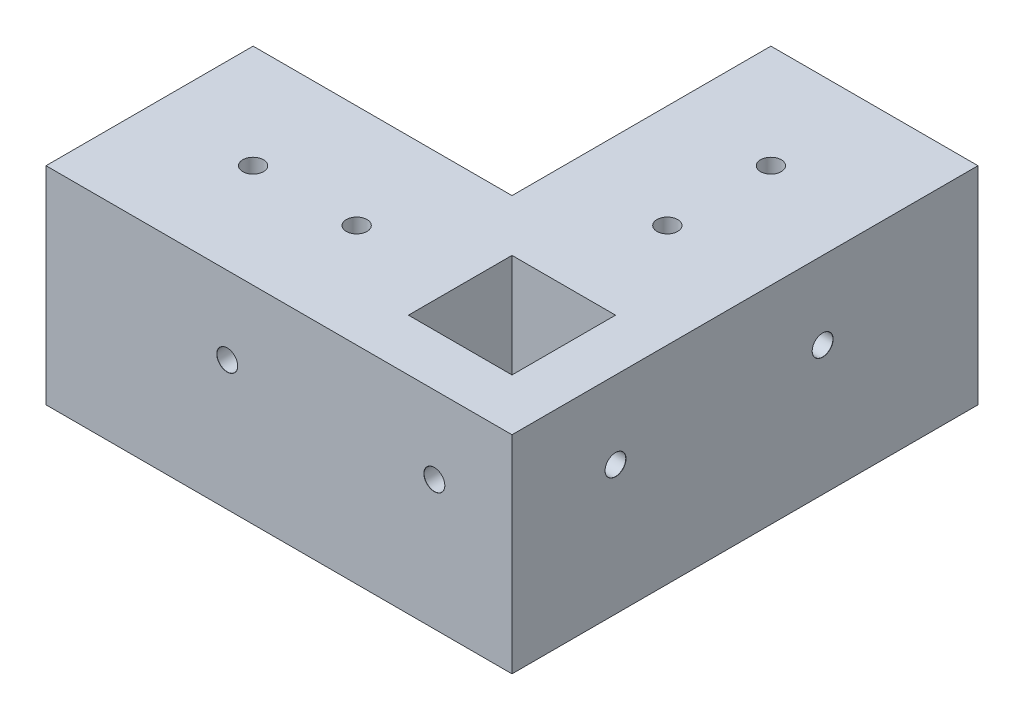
SolidWorks part; units mm, degrees
ref_plane "Front Plane" through (0, 0, 0) normal (0, 0, 1) x (1, 0, 0)
ref_plane "Top Plane" through (0, 0, 0) normal (0, 1, 0) x (1, 0, 0)
ref_plane "Right Plane" through (0, 0, 0) normal (1, 0, 0) x (0, 0, -1)
sketch "Sketch2" plane through (0, 0, 0) normal (0, 1, 0) x (1, 0, 0)
  line L0 (0, 0) -> (-50, 0)
  line L1 (-50, 0) -> (-50, -40)
  line L2 (-50, -40) -> (40, -40)
  line L3 (40, -40) -> (40, 50)
  line L4 (40, 50) -> (0, 50)
  line L5 (0, 50) -> (0, 0)
  dimension "D1" = 40
  dimension "D2" = 40
  dimension "D3" = 50
  dimension "D4" = 50
extrude "Boss-Extrude1" add sketch "Sketch2" along normal blind 40 contours L4 L5 L0 L1 L2 L3
sketch "Sketch6" plane through (40, 0, 0) normal (1, 0, 0) x (0, 0, -1)
  line L0 (-40, 40) -> (-40, 0) construction
  line L1 (-40, 40) -> (50, 40) construction
  point P0 (-20, 25)
  point P2 (-20, -5)
  point P11 (20, 25)
  point P13 (20, -5)
  dimension "D1" = 20
  dimension "D2" = 15
  dimension "D3" = 30
  dimension "D4" = 40
hole_wizard "Ø4.0mm Dowel Hole1" positions "Sketch6" profile "Sketch8" hole size "Ø4.0" standard "ANSI Metric"
sketch "Sketch8" plane through (40, 25, 20) normal (0, 1, 0) x (0, 0, -1)
  line L0 (0, 0) -> (0, 11.2017)
  line L1 (0, 11.2017) -> (2, 10)
  line L2 (2, 10) -> (2, 0.025)
  line L3 (2, 0.025) -> (2.025, 0)
  line L5 (2.025, 0) -> (0, 0)
  line L6 (-2, 0.025) -> (-2.025, 0) construction
  line L10 (0, 11.2017) -> (-2, 10) construction
  line L11 (0, -6.35) -> (0, 107.95) construction
  dimension "Hole Dia." = 4
  dimension "Hole Depth" = 10
  dimension "Near C'Sink Dia." = 4.05
  dimension "Near C'Sink Angle" = 90
  dimension "Drill Angle" = 118
sketch "Sketch13" plane through (0, 0, 40) normal (0, 0, 1) x (1, 0, 0)
  line L0 (40, 40) -> (40, 0) construction
  line L1 (-50, 40) -> (40, 40) construction
  point P0 (25, 25)
  point P2 (25, -5)
  point P15 (-15, 25)
  point P16 (-15, -5)
  dimension "D1" = 15
  dimension "D2" = 30
  dimension "D3" = 15
  dimension "D4" = 40
hole_wizard "Ø4.0mm Dowel Hole3" positions "Sketch13" profile "Sketch14" hole size "Ø4.0" standard "ANSI Metric"
sketch "Sketch14" plane through (25, 25, 40) normal (1, 0, 0) x (0, -1, 0)
  line L0 (0, 0) -> (0, 11.2017)
  line L1 (0, 11.2017) -> (2, 10)
  line L2 (2, 10) -> (2, 0.025)
  line L3 (2, 0.025) -> (2.025, 0)
  line L5 (2.025, 0) -> (0, 0)
  line L6 (-2, 0.025) -> (-2.025, 0) construction
  line L10 (0, 11.2017) -> (-2, 10) construction
  line L11 (0, -6.35) -> (0, 107.95) construction
  dimension "Hole Dia." = 4
  dimension "Hole Depth" = 10
  dimension "Near C'Sink Dia." = 4.05
  dimension "Near C'Sink Angle" = 90
  dimension "Drill Angle" = 118
sketch "Sketch17" plane through (0, 40, 0) normal (0, 1, 0) x (1, 0, 0)
  line L0 (40, -40) -> (40, 50) construction
  line L1 (10, -10) -> (30, -10)
  line L2 (10, -10) -> (10, -30)
  line L3 (10, -30) -> (30, -30)
  line L4 (30, -10) -> (30, -30)
  line L5 (-50, -40) -> (40, -40) construction
  dimension "D1" = 20
  dimension "D2" = 20
  dimension "D3" = 10
  dimension "D4" = 10
extrude "Cut-Extrude3" cut sketch "Sketch17" against normal blind 30
fillet "Fillet1" radius 5 2 edges at (-25, 0, 0) (0, 0, -25)
sketch "Sketch18" plane through (0, 40, 0) normal (0, 1, 0) x (1, 0, 0)
  line L1 (0, 0) -> (-50, 0) construction
  line L2 (-50, 0) -> (-50, -40) construction
  line L3 (-50, -40) -> (40, -40) construction
  line L4 (40, -40) -> (40, 50) construction
  line L5 (40, 50) -> (0, 50) construction
  circle A0 centre (-30, -20) radius 2
  circle A1 centre (-10, -20) radius 2
  circle A2 centre (20, 30) radius 2
  circle A3 centre (20, 10) radius 2
  point P12 (-49.2583, -13.7712)
  point P13 (0, 0)
  dimension "D5" = 4
  dimension "D6" = 4
  dimension "D9" = 4
  dimension "D10" = 4
  dimension "D1" = 20
  dimension "D2" = 20
  dimension "D3" = 20
  dimension "D4" = 20
  dimension "D7" = 20
  dimension "D8" = 20
  dimension "D11" = 20
  dimension "D12" = 20
  dimension "D13" = 70
extrude "Cut-Extrude4" cut sketch "Sketch18" against normal blind 15
